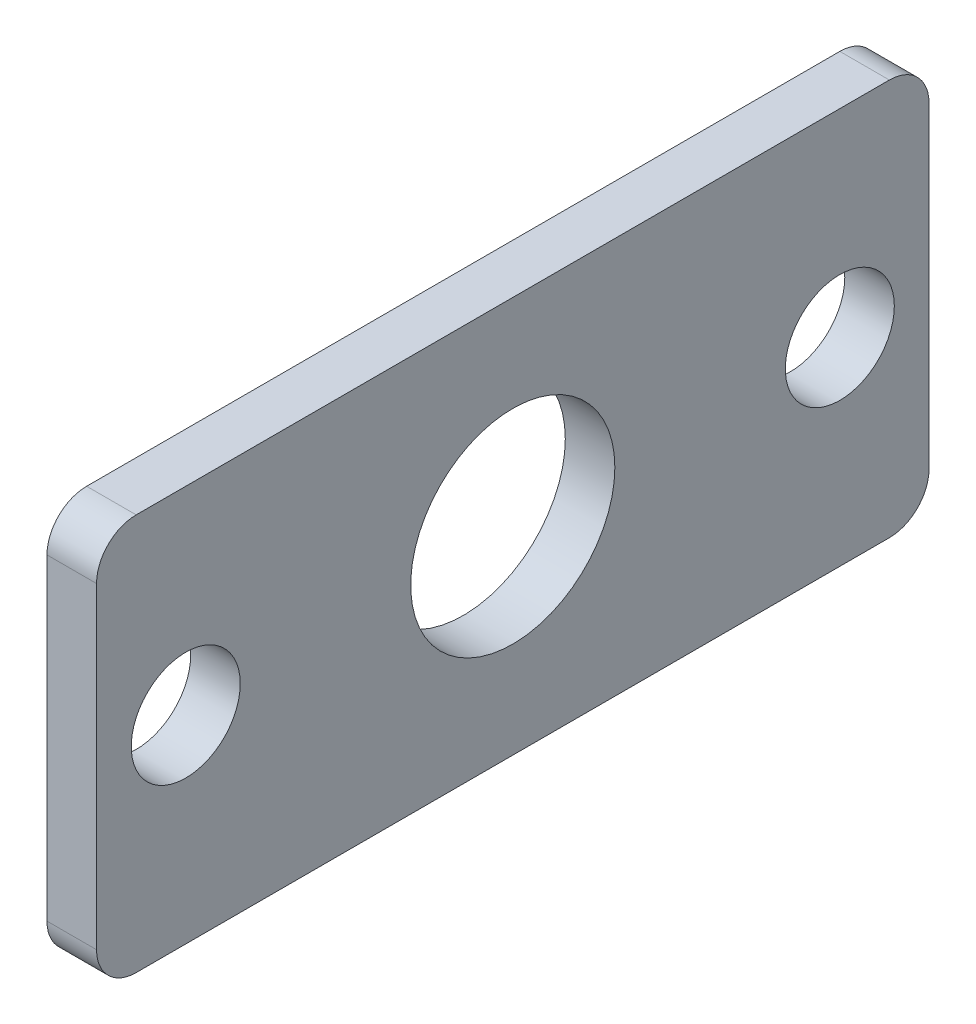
SolidWorks part; units mm, degrees
ref_plane "前视基准面" through (0, 0, 0) normal (0, 0, 1) x (1, 0, 0)
ref_plane "上视基准面" through (0, 0, 0) normal (0, 1, 0) x (1, 0, 0)
ref_plane "右视基准面" through (0, 0, 0) normal (1, 0, 0) x (0, 0, -1)
sketch "草图1" plane through (0, 0, 0) normal (1, 0, 0) x (0, 0, -1)
  line L0 (0, 18) -> (0, 2)
  line L1 (42, 18) -> (42, 2)
  line L2 (2, 20) -> (40, 20)
  line L3 (2, 0) -> (40, 0)
  arc A0 (0, 2) -> (2, 0) centre (2, 2) ccw
  arc A1 (2, 20) -> (0, 18) centre (2, 18) ccw
  circle A2 centre (37.5, 10) radius 2.75
  circle A3 centre (4.5, 10) radius 2.75
  arc A4 (42, 18) -> (40, 20) centre (40, 18) ccw
  arc A5 (40, 0) -> (42, 2) centre (40, 2) ccw
extrude "凸台-拉伸1" add sketch "草图1" along normal blind 2.5
sketch "草图2" plane through (2.5, 0, 0) normal (1, 0, 0) x (0, 0, -1)
  circle A0 centre (21, 10) radius 5.15
extrude "切除-拉伸1" cut sketch "草图2" against normal blind 2.5
